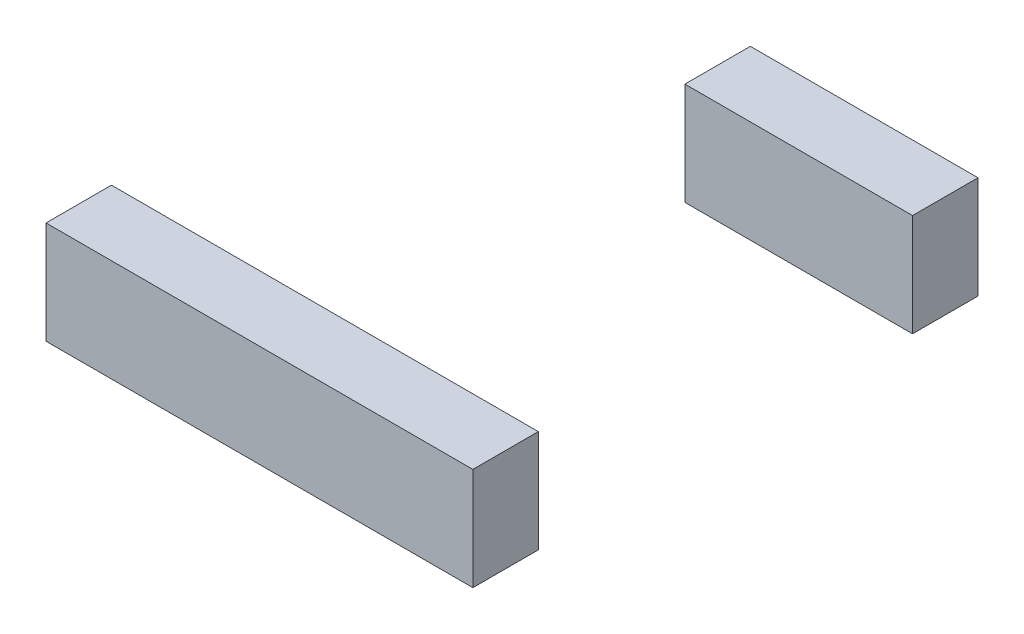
SolidWorks part; units mm, degrees
ref_plane "前视基准面" through (0, 0, 0) normal (0, 0, 1) x (1, 0, 0)
ref_plane "上视基准面" through (0, 0, 0) normal (0, 1, 0) x (1, 0, 0)
ref_plane "右视基准面" through (0, 0, 0) normal (1, 0, 0) x (0, 0, -1)
sketch "草图1" plane through (0, 0, 0) normal (0, 1, 0) x (1, 0, 0)
  line L1 (0, 0) -> (30, 0)
  line L2 (0, 0) -> (0, 4.6)
  line L3 (0, 4.6) -> (30, 4.6)
  line L4 (30, 0) -> (30, 4.6)
  line L5 (14, 30.9) -> (30, 30.9)
  line L6 (14, 30.9) -> (14, 35.5)
  line L7 (14, 35.5) -> (30, 35.5)
  line L8 (30, 30.9) -> (30, 35.5)
  dimension "D1" = 30
  dimension "D2" = 16
  dimension "D3" = 4.6
  dimension "D4" = 4.6
  dimension "D5" = 30.9
extrude "凸台-拉伸1" add sketch "草图1" along normal blind 7.2
